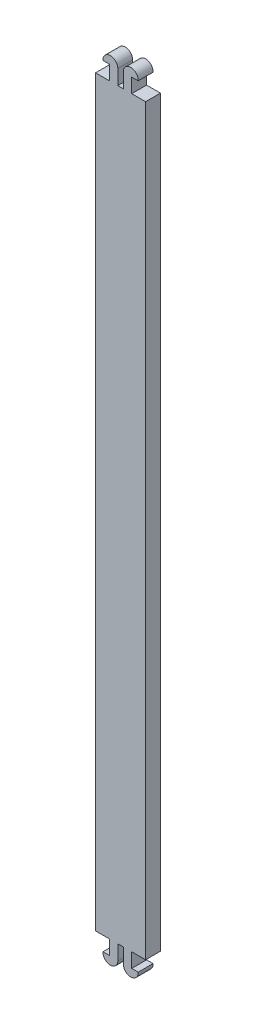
SolidWorks part; units mm, degrees
ref_plane "Front Plane" through (0, 0, 0) normal (0, 0, 1) x (1, 0, 0)
ref_plane "Top Plane" through (0, 0, 0) normal (0, 1, 0) x (1, 0, 0)
ref_plane "Right Plane" through (0, 0, 0) normal (1, 0, 0) x (0, 0, -1)
sketch "Sketch1" plane through (0, 0, 0) normal (0, 0, 1) x (1, 0, 0)
  line L0 (0.654, 37.5) -> (0.654, 40.5) construction
  line L1 (5.05, -37.5) -> (-5.05, -37.5) construction
  line L2 (5.05, -112.5) -> (5.05, 37.5)
  line L3 (5.05, 37.5) -> (2.254, 37.5)
  line L4 (-5.05, -112.5) -> (-5.05, 37.5)
  line L5 (5.05, -37.5) -> (-5.05, 37.5) construction
  line L6 (5.05, 37.5) -> (-5.05, -37.5) construction
  line L7 (2.154, 37.5) -> (2.154, 40.5) construction
  line L8 (2.154, 40.5) -> (3.462, 40.5) construction
  line L9 (0, 0) -> (0, 30.9108) construction
  line L10 (3.462, 40.5) -> (3.462, 37.5) construction
  line L11 (0.554, 37.5) -> (0.554, 40.5)
  line L12 (2.254, 40.4) -> (3.5587, 40.4)
  line L13 (2.254, 37.5) -> (2.254, 40.4)
  line L14 (0.554, 37.5) -> (0.554, 40.5) construction
  line L15 (-2.254, 37.5) -> (-2.254, 40.4)
  line L16 (-2.254, 40.4) -> (-3.5587, 40.4)
  line L17 (-0.554, 37.5) -> (-0.554, 40.5)
  line L18 (-0.554, 37.5) -> (-2.254, 37.5) construction
  line L19 (-2.254, 37.5) -> (-5.05, 37.5)
  line L20 (2.154, 37.5) -> (0.654, 37.5) construction
  line L21 (0.554, 37.5) -> (-0.554, 37.5)
  line L22 (0.654, 37.5) -> (0.554, 37.5) construction
  line L23 (2.254, 37.5) -> (2.154, 37.5) construction
  line L24 (-2.254, -112.5) -> (-5.05, -112.5)
  line L25 (-2.254, -112.5) -> (-2.254, -115.4)
  line L26 (-2.254, -115.4) -> (-3.5587, -115.4)
  line L27 (-0.554, -112.5) -> (-0.554, -115.5)
  line L28 (0.554, -112.5) -> (-0.554, -112.5)
  line L29 (0.554, -112.5) -> (0.554, -115.5)
  line L30 (2.254, -115.4) -> (3.5587, -115.4)
  line L31 (2.254, -112.5) -> (2.254, -115.4)
  line L32 (5.05, -112.5) -> (2.254, -112.5)
  arc A0 (3.462, 40.5) -> (0.654, 40.5) centre (2.058, 40.5) ccw construction
  arc A1 (3.5587, 40.4) -> (0.554, 40.5) centre (2.058, 40.5) ccw
  arc A2 (-3.5587, 40.4) -> (-0.554, 40.5) centre (-2.058, 40.5) cw
  arc A3 (-3.5587, -115.4) -> (-0.554, -115.5) centre (-2.058, -115.5) ccw
  arc A4 (3.5587, -115.4) -> (0.554, -115.5) centre (2.058, -115.5) cw
  point P0 (0, 0)
extrude "Boss-Extrude1" add sketch "Sketch1" along normal blind 3
equation "\"Thick\"= 3"
equation "\"h\"= 3"
equation "\"kerf\"= .2"
equation "\"D7@Sketch1\"= ( \"ancho_total\" / 2 ) - ( ( \"kerf\" / 2 ) + ( \"h\" / 2 ) + ( \"Per_def\" * .5 ) )"
equation "\"Length\"= \"Thick\""
equation "\"D4@Sketch1\" = \"h\" / 2"
equation "\"D5@Sketch1\"= \"h\" / 2"
equation "\"Deflection\"= .4 * \"Thick\""
equation "\"D8@Sketch1\"=\"kerf\"/2"
equation "\"D1@Boss-Extrude1\"=\"Thick\""
equation "\"Strain\"= \"Deflection\" / \"Length\""
equation "\"D3@Sketch1\"=\"Length\""
equation "\"Per_def\"= 1.09 * ( \"Strain\" * \"Length\" * \"Length\" ) / \"h\""
equation "\"D6@Sketch1\" = \"Per_def\" * .5"
equation "\"D2@Sketch1\"= \"Per_def\""
equation "\"ancho_total\"= 10 + \"kerf\" / 2"
